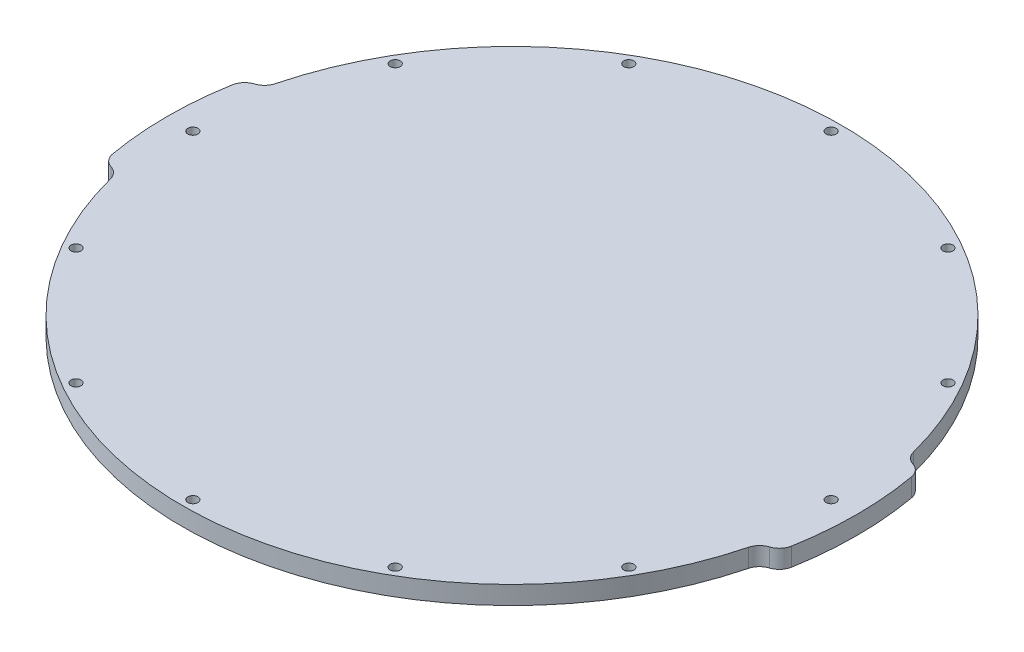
SolidWorks part; units mm, degrees
ref_plane "Front Plane" through (0, 0, 0) normal (0, 0, 1) x (1, 0, 0)
ref_plane "Top Plane" through (0, 0, 0) normal (0, 1, 0) x (1, 0, 0)
ref_plane "Right Plane" through (0, 0, 0) normal (1, 0, 0) x (0, 0, -1)
sketch "Sketch1" plane through (0, 0, 0) normal (0, 1, 0) x (1, 0, 0)
  line L0 (0, 0) -> (-111.234, 19.6136) construction
  line L1 (0, 0) -> (-139.7786, 0) construction
  line L2 (0, 0) -> (-111.234, -19.6136) construction
  line L3 (0, 0) -> (111.234, 19.6136) construction
  line L4 (0, 0) -> (111.234, -19.6136) construction
  circle A0 centre (0, 0) radius 104.55 construction
  circle A1 centre (0, 104.55) radius 1.65
  circle A2 centre (52.275, 90.543) radius 1.65
  circle A3 centre (90.543, 52.275) radius 1.65
  circle A4 centre (104.55, 0) radius 1.65
  circle A5 centre (90.543, -52.275) radius 1.65
  circle A6 centre (52.275, -90.543) radius 1.65
  circle A7 centre (0, -104.55) radius 1.65
  circle A8 centre (-52.275, -90.543) radius 1.65
  circle A9 centre (-90.543, -52.275) radius 1.65
  circle A10 centre (-104.55, 0) radius 1.65
  circle A11 centre (-90.543, 52.275) radius 1.65
  circle A12 centre (-52.275, 90.543) radius 1.65
  circle A13 centre (0, 0) radius 107.95 construction
  circle A14 centre (0, 0) radius 112.95 construction
  arc A15 (-111.234, -19.6136) -> (-111.234, 19.6136) centre (0, 0) cw
  arc A16 (111.234, -19.6136) -> (111.234, 19.6136) centre (0, 0) ccw
  arc A17 (-111.234, -19.6136) -> (-105.328, -23.6479) centre (-106.31, -18.7453) ccw
  arc A18 (-111.234, 19.6136) -> (-105.328, 23.6479) centre (-106.31, 18.7453) cw
  arc A19 (111.234, -19.6136) -> (105.328, -23.6479) centre (106.31, -18.7453) cw
  arc A20 (111.234, 19.6136) -> (105.328, 23.6479) centre (106.31, 18.7453) ccw
  arc A21 (-105.328, 23.6479) -> (105.328, 23.6479) centre (0, 0) cw
  arc A22 (105.328, -23.6479) -> (-105.328, -23.6479) centre (0, 0) cw
  point P30 (0, 0)
  dimension "D1" = 3.3
  dimension "D2" = 209.1
  dimension "D4" = 215.9
  dimension "D5" = 5
  dimension "D6" = 10
  dimension "D3" = 12
extrude "Boss-Extrude1" add sketch "Sketch1" along normal blind 6
fillet "Fillet1" radius 5 4 edges at (105.328, 3, 23.6479) (105.328, 3, -23.6479) (-105.328, 3, -23.6479) (-105.328, 3, 23.6479)
